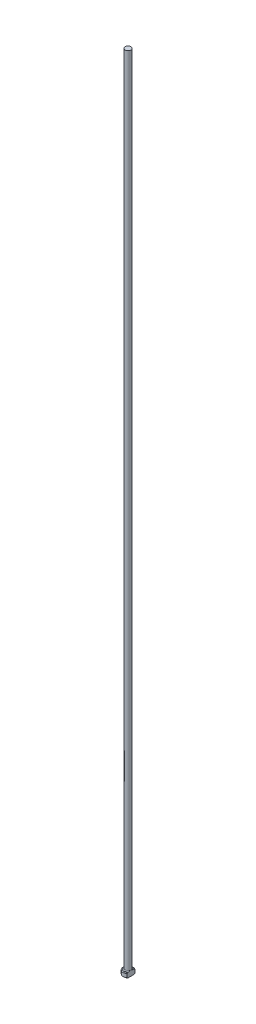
SolidWorks part; units mm, degrees
ref_plane "Front Plane" through (0, 0, 0) normal (0, 0, 1) x (1, 0, 0)
ref_plane "Top Plane" through (0, 0, 0) normal (0, 1, 0) x (1, 0, 0)
ref_plane "Right Plane" through (0, 0, 0) normal (1, 0, 0) x (0, 0, -1)
sketch "Sketch1" plane through (0, 0, 0) normal (0, 0, 1) x (1, 0, 0)
  line L0 (0, 259.9588) -> (0, -15.1925) construction
  line L1 (0, 0) -> (-1.5, 0)
  line L2 (-1.5, 0) -> (-1.5, 1.5)
  line L3 (-1.5, 1.5) -> (-0.9, 1.5)
  line L4 (-0.9, 1.5) -> (-0.9, 250)
  line L5 (-0.9, 250) -> (0, 250)
  line L6 (0, 250) -> (0, 0)
  dimension "L" = 250
  dimension "H" = 3
  dimension "T" = 1.5
  dimension "D" = 1.8
revolve "Revolve1" add sketch "Sketch1" angle 360 about L0
chamfer "Chamfer1" distance 0.2 angle 45 2 edges at (0, 1.5, 1.5) (0, 0, 1.5)
fillet "Fillet1" radius 0.2 1 edges at (0, 1.5, 0.9)
sketch "Sketch2" plane through (0, 0, 0) normal (0, 1, 0) x (1, 0, 0)
  line L0 (0.9, 1.2) -> (0.9, -1.2)
  circle A0 centre (0, 0) radius 1.5 construction
  arc A1 (0.9, -1.2) -> (0.9, 1.2) centre (0, 0) ccw
  circle A2 centre (0, 0) radius 0.9 construction
extrude "KEY" cut sketch "Sketch2" along normal through all
